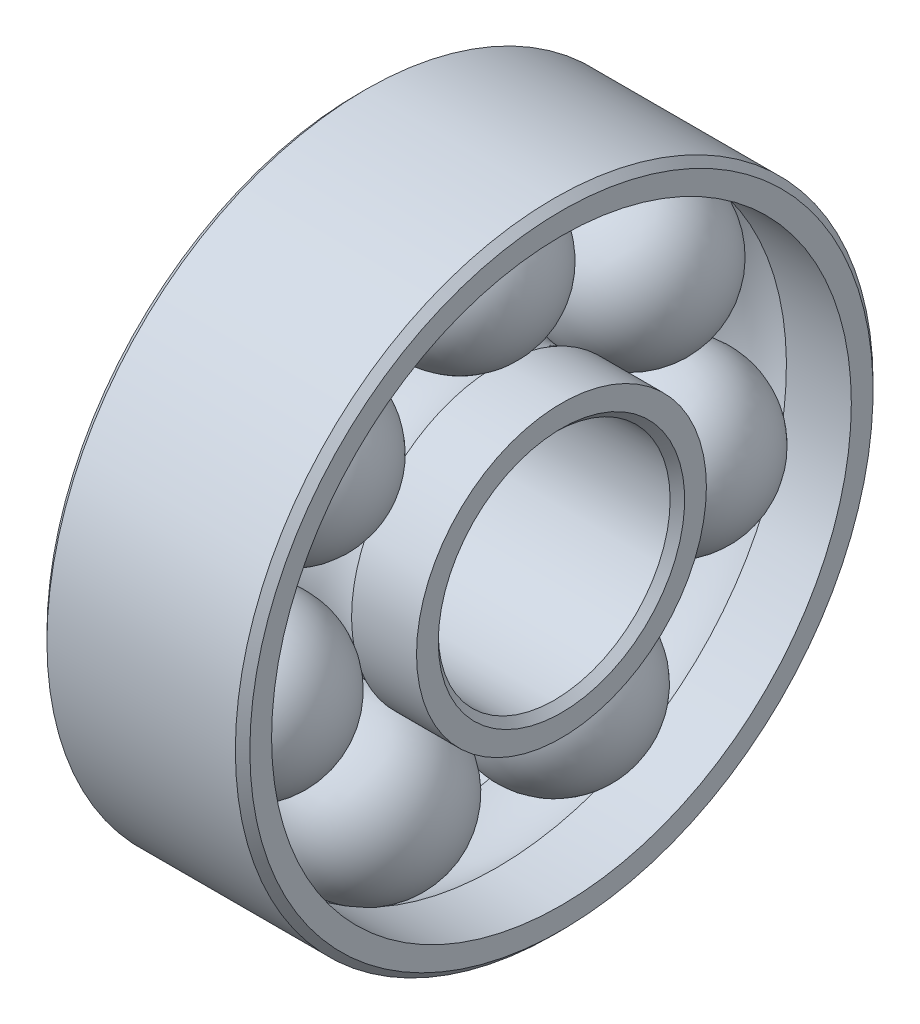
SolidWorks part; units mm, degrees
ref_plane "Face" through (0, 0, 0) normal (0, 0, 1) x (1, 0, 0)
ref_plane "Dessus" through (0, 0, 0) normal (0, 1, 0) x (1, 0, 0)
ref_plane "Droite" through (0, 0, 0) normal (1, 0, 0) x (0, 0, -1)
sketch "Esquisse2" plane through (0, 0, 0) normal (0, 0, 1) x (1, 0, 0)
  line L0 (-74.1101, 0) -> (95.3304, 0) construction
  line L1 (-3.25, 4) -> (3.25, 4)
  line L2 (3.25, 4) -> (3.5, 4.25)
  line L3 (3.5, 4.25) -> (3.5, 5)
  line L4 (3.5, 5) -> (1.261, 5)
  line L5 (0, 0) -> (0, 59.481) construction
  line L6 (-3.5, 4.25) -> (-3.5, 5)
  line L7 (-3.25, 4) -> (-3.5, 4.25)
  line L9 (-1.261, 5) -> (-3.5, 5)
  arc A0 (-1.261, 5) -> (1.261, 5) centre (0, 7.5) ccw
  point P11 (0, 5)
  point P13 (0, 4)
  dimension "D1" = 8
  dimension "D2" = 45
  dimension "D3" = 0.25
  dimension "D4" = 1
  dimension "D5" = 3.5
revolve "Base-Révolution" add sketch "Esquisse2" angle 360 about L0
sketch "Esquisse3" plane through (0, 0, 0) normal (1, 0, 0) x (0, 0, -1)
  line L0 (0, 12.548) -> (0, -1.6209) construction
  line L1 (0, 10.31) -> (0, 4.69)
  arc A5 (0, 4.69) -> (0, 10.31) centre (0, 7.5) ccw
  circle A6 centre (0, 0) radius 7.5
  circle A7 centre (0, 0) radius 7.5 construction
  dimension "D3" = 2.5
revolve "Boss.-Révol.1" add sketch "Esquisse3" angle 360 about L0
pattern_circular "Répétition circulaire1" count 7 over 360 about axis through (-74.1101, 0, 0) along (1, 0, 0)
sketch "Esquisse5" plane through (0, 0, 0) normal (0, 0, 1) x (1, 0, 0)
  line L0 (-5.2789, 0) -> (6.2985, 0) construction
  line L1 (-74.1101, 0) -> (95.3304, 0) construction
  line L2 (0, 11.3567) -> (0, -10.2522) construction
  line L3 (0, 12.548) -> (0, -1.6209) construction
  line L4 (-3.25, 11) -> (3.25, 11)
  line L5 (3.5, 10.75) -> (3.5, 10)
  line L6 (3.5, 10) -> (1.261, 10)
  line L7 (-3.25, 11) -> (-3.5, 10.75)
  line L8 (3.25, 11) -> (3.5, 10.75)
  line L11 (-3.5, 10) -> (-1.261, 10)
  line L12 (-3.5, 10.75) -> (-3.5, 10)
  arc A3 (1.261, 10) -> (-1.261, 10) centre (0, 7.5) ccw
  point P19 (0, 11)
  dimension "D4" = 0.25
  dimension "D1" = 22
  dimension "D2" = 20
  dimension "D3" = 45
  dimension "D5" = 7
revolve "Boss.-Révol.2" add sketch "Esquisse5" angle 360 about L0
